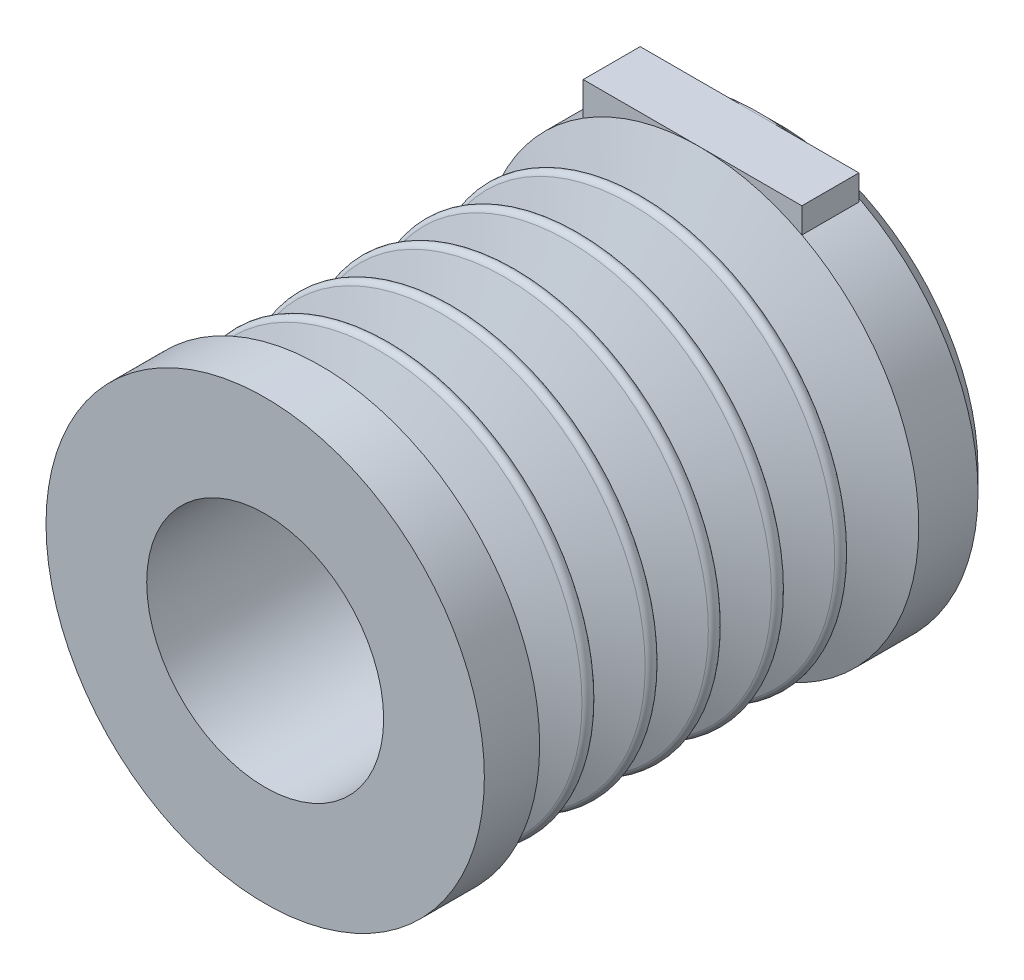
SolidWorks part; units mm, degrees
ref_plane "Plan1" through (0, 0, 0) normal (0, 0, 1) x (1, 0, 0)
ref_plane "Plan2" through (0, 0, 0) normal (0, 1, 0) x (1, 0, 0)
ref_plane "Plan3" through (0, 0, 0) normal (1, 0, 0) x (0, 0, -1)
sketch "Esquisse1" plane through (0, 0, 0) normal (1, 0, 0) x (0, 0, -1)
  line L0 (-21.5, 0) -> (11, 0) construction
  line L1 (0, 5.55) -> (0, 3)
  line L2 (-2, 5.55) -> (-2.8, 3.352)
  line L3 (-13, 3) -> (0, 3)
  line L4 (-13, 5.55) -> (-13, 3)
  line L5 (-2, 5.55) -> (0, 5.55)
  line L6 (-4.4, 3.352) -> (-5.2, 5.55)
  line L7 (-2.8, 3.352) -> (-3.6, 5.55)
  line L8 (-3.6, 5.55) -> (-4.4, 3.352)
  line L9 (-5.2, 5.55) -> (-6, 3.352)
  line L10 (-6.8, 5.55) -> (-6.8, 4) construction
  line L11 (-6.8, 5.55) -> (-7.6, 3.352)
  line L12 (-8.4, 5.55) -> (-7.6, 3.352)
  line L13 (-10, 5.55) -> (-9.2, 3.352)
  line L14 (-10.8, 3.352) -> (-10, 5.55)
  line L15 (-6.8, 5.55) -> (-6, 3.352)
  line L16 (-9.2, 3.352) -> (-8.4, 5.55)
  line L17 (-11.6, 5.55) -> (-10.8, 3.352)
  line L18 (-11.6, 5.55) -> (-13, 5.55)
  dimension "D9" = 40
  dimension "D10" = 40
  dimension "D1" = 5.55
  dimension "D2" = 3
  dimension "D3" = 13
  dimension "D4" = 110
  dimension "D5" = 40
  dimension "D6" = 2
  dimension "D7" = 40
  dimension "D8" = 1.6
  dimension "D11" = 40
revolve "corps" add sketch "Esquisse1" angle 360 about L0
fillet "Congé1" radius 0.15 5 edges at (5.55, 0, 3.6) (5.55, 0, 5.2) (5.55, 0, 6.8) (5.55, 0, 8.4) (5.55, 0, 10)
fillet "Congé2" radius 0.2 6 edges at (3.352, 0, 2.8) (3.352, 0, 4.4) (3.352, 0, 6) (3.352, 0, 7.6) (3.352, 0, 9.2) (3.352, 0, 10.8)
chamfer "Chanfrein1" distance 0.5 angle 45 1 edges at (5.55, 0, 0)
ref_plane "Plan médian poulie motrice" through (0, 0, 6.8) normal (0, 0, -1) x (-1, 0, 0)
sketch "Diamètre primitif poulie motrice" plane through (0, 0, 6.8) normal (0, 0, -1) x (-1, 0, 0)
  circle A0 centre (0, 0) radius 6.35 construction
  dimension "D1" = 12.7
ref_plane "Plan4" through (0, 5.55, 0) normal (0, 1, 0) x (-1, 0, 0)
sketch "Esquisse2" plane through (0, 5.55, 0) normal (0, 1, 0) x (-1, 0, 0)
  line L0 (-5.55, 2) -> (5.55, 2) construction
  line L1 (-2.5906, 2) -> (2.9475, 2)
  line L2 (-2.5906, 2) -> (-2.5906, 0.5565)
  line L3 (-2.5906, 0.5565) -> (2.9475, 0.5565)
  line L4 (2.9475, 2) -> (2.9475, 0.5565)
extrude "Boss.-Extru.1" add sketch "Esquisse2" against normal up to next
